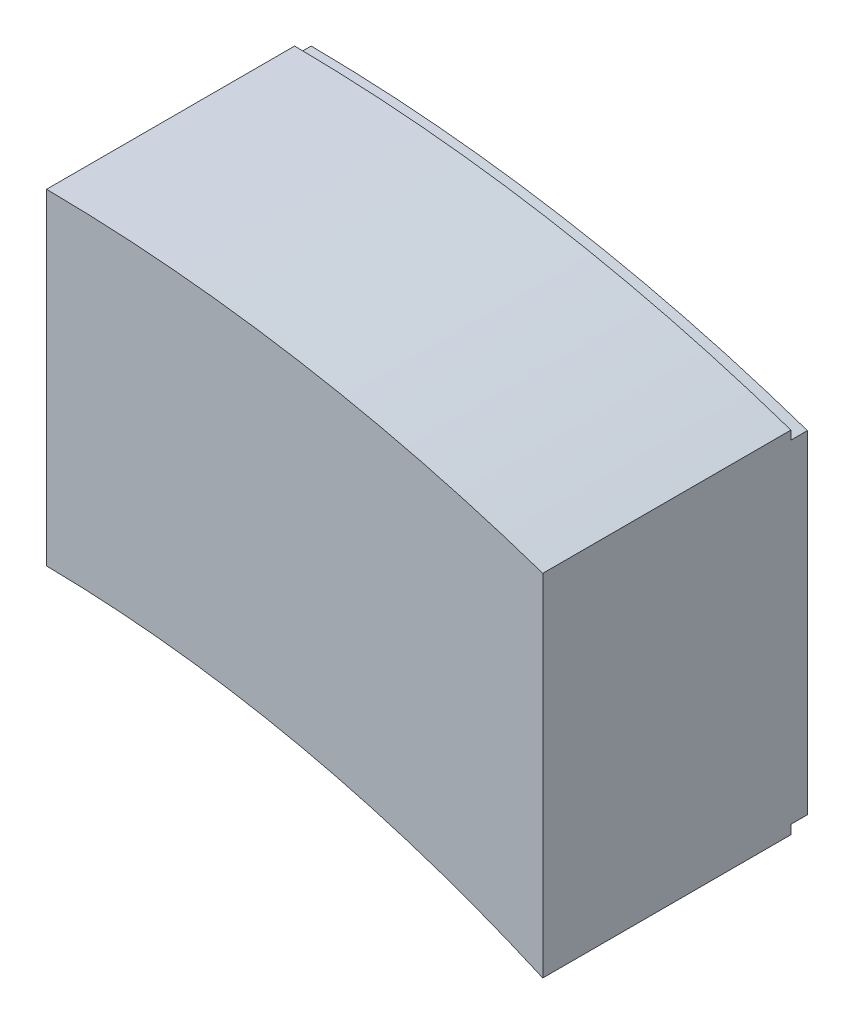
SolidWorks part; units mm, degrees
ref_plane "Front" through (0, 0, 0) normal (0, 0, 1) x (1, 0, 0)
ref_plane "Top" through (0, 0, 0) normal (0, 1, 0) x (1, 0, 0)
ref_plane "Right" through (0, 0, 0) normal (1, 0, 0) x (0, 0, -1)
sketch "Sketch2" plane through (0, 0, 0) normal (0, 1, 0) x (1, 0, 0)
  line L1 (-7.5, 8) -> (7.5, 8)
  line L2 (-7.5, 8) -> (-7.5, 0)
  line L3 (-7.5, 0) -> (7.5, 0)
  line L4 (7.5, 8) -> (7.5, 0)
  dimension "D1" = 15
  dimension "D2" = 8
extrude "Extrude1" add sketch "Sketch2" along normal blind 7.307
sketch "Sketch3" plane through (0, -0.693, -8) normal (0, 0, 1) x (1, 0, 0)
  line L0 (7.5, 0.693) -> (7.5, -2.5935)
  line L1 (7.5, 0.693) -> (-7.5, 0.693)
  line L2 (7.5, 0.693) -> (-7.5, 0.693) construction
  line L4 (-7.5, 8) -> (-7.5, 0.693) construction
  arc A0 (7.5, -2.5935) -> (-7.5, 0.693) centre (-7.9957, -37.4438) ccw
  dimension "D1" = 38.1401
  dimension "D2" = 3.2865
extrude "Extrude3" add sketch "Sketch3" along normal up to surface (8 mm away)
sketch "Sketch4" plane through (0, 0, -8) normal (0, 0, -1) x (-1, 0, 0)
  line L0 (-7.5, 7.307) -> (7.5, 7.307) construction
  line L1 (-7.5, 7.307) -> (7.5, 7.307)
  line L2 (7.5, 7.307) -> (7.5, 9.861)
  arc A0 (7.5, 9.861) -> (-7.5, 7.307) centre (7.955, -38.1368) ccw
  dimension "D1" = 48
  dimension "D2" = 2.554
extrude "Extrude4" add sketch "Sketch4" against normal up to surface (8 mm away)
sketch "Sketch5" plane through (0, 0, -8) normal (0, 0, -1) x (-1, 0, 0)
  line L0 (7.5, 9.861) -> (7.5, 0) construction
  line L2 (7.5, 9.861) -> (7.5, 9.611)
  line L3 (-7.5, 7.307) -> (-7.5, -3.2865) construction
  line L4 (-7.5, 7.307) -> (-7.5, 7.0429)
  line L5 (7.5, 0) -> (7.5, 0.25)
  line L6 (-7.5, -3.2865) -> (-7.5, -3.0131)
  arc A2 (7.4968, 0.25) -> (-7.6016, -3.0581) centre (7.9957, -38.1368) ccw
  arc A3 (7.5, 0.25) -> (-7.5, -3.0131) centre (7.9957, -38.1368) ccw
  arc A4 (7.5, 9.861) -> (-7.5, 7.307) centre (7.955, -38.1368) ccw construction
  arc A5 (7.5024, 9.611) -> (-7.4195, 7.0703) centre (7.955, -38.1368) ccw
  arc A6 (7.5, 9.611) -> (-7.5, 7.0429) centre (7.955, -38.1368) ccw
  arc A7 (7.5, 9.861) -> (-7.5, 7.307) centre (7.955, -38.1368) ccw
  arc A8 (7.5, 0) -> (-7.5, -3.2865) centre (7.9957, -38.1368) ccw construction
  arc A9 (7.5, 0) -> (-7.5, -3.2865) centre (7.9957, -38.1368) ccw
  dimension "D1" = 0.25
  dimension "D2" = 0.25
extrude "Extrude5" cut sketch "Sketch5" against normal blind 0.5
